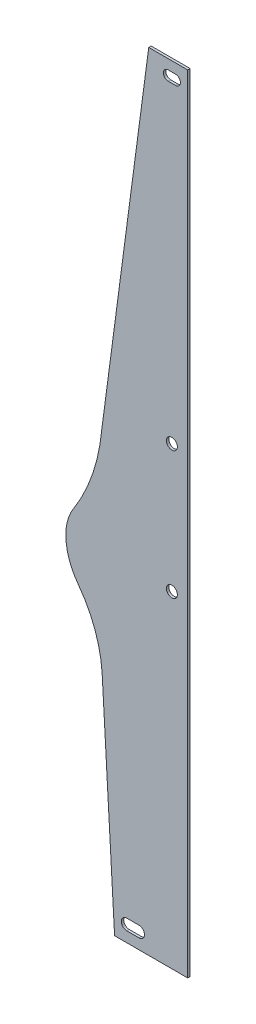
SolidWorks part; units mm, degrees
ref_plane "Face" through (0, 0, 0) normal (0, 0, 1) x (1, 0, 0)
ref_plane "Dessus" through (0, 0, 0) normal (0, 1, 0) x (1, 0, 0)
ref_plane "Droite" through (0, 0, 0) normal (1, 0, 0) x (0, 0, -1)
sketch "Esquisse1" plane through (0, 0, 0) normal (0, 0, 1) x (1, 0, 0)
  line L0 (44.0382, 237.9896) -> (44.0382, -407.0104)
  line L1 (44.0382, -407.0104) -> (-15.9618, -407.0104)
  line L2 (-26.1195, -226.3953) -> (-15.9618, -407.0104)
  line L3 (44.0382, 237.9896) -> (12.0382, 237.9896)
  line L4 (4.0382, -398.5104) -> (-5.9618, -398.5104)
  line L5 (-27.9897, -64.1227) -> (12.0382, 237.9896)
  line L6 (4.0382, -389.5104) -> (-5.9618, -389.5104)
  line L7 (34.0382, 221.9896) -> (28.0382, 221.9896)
  line L8 (34.0382, 229.9896) -> (28.0382, 229.9896)
  arc A0 (-55.9618, -142.0104) -> (-45.9618, -172.0104) centre (-5.9618, -142.0104) ccw
  arc A1 (-26.1195, -226.3953) -> (-45.9618, -172.0104) centre (-125.9618, -232.0104) ccw
  arc A2 (28.0382, 229.9896) -> (28.0382, 221.9896) centre (28.0382, 225.9896) ccw
  circle A3 centre (31.0382, -34.0104) radius 4.5
  circle A4 centre (31.0382, -139.0104) radius 4.5
  arc A5 (-49.646, -120.4378) -> (-27.9897, -64.1227) centre (-175.9618, -39.5409) ccw
  arc A6 (-5.9618, -389.5104) -> (-5.9618, -398.5104) centre (-5.9618, -394.0104) ccw
  arc A7 (4.0382, -398.5104) -> (4.0382, -389.5104) centre (4.0382, -394.0104) ccw
  arc A8 (34.0382, 221.9896) -> (34.0382, 229.9896) centre (34.0382, 225.9896) ccw
  arc A9 (-49.646, -120.4378) -> (-55.9618, -142.0104) centre (-15.9618, -142.0104) ccw
  dimension "D4" = 50
  dimension "D5" = 100
  dimension "D6" = 50
  dimension "D7" = 8
  dimension "D8" = 9
  dimension "D11" = 268
  dimension "D13" = 150
  dimension "D18" = 220
  dimension "D24" = 40
  dimension "D1" = 645
  dimension "D2" = 32
  dimension "D3" = 265
  dimension "D9" = 16
  dimension "D10" = 105
  dimension "D12" = 12
  dimension "D14" = 170
  dimension "D15" = 60
  dimension "D16" = 175
  dimension "D17" = 10
  dimension "D19" = 13
  dimension "D20" = 50
  dimension "D21" = 6
  dimension "D22" = 13
  dimension "D25" = 367.4695
extrude "Extrusion1" add sketch "Esquisse1" along normal blind 2
